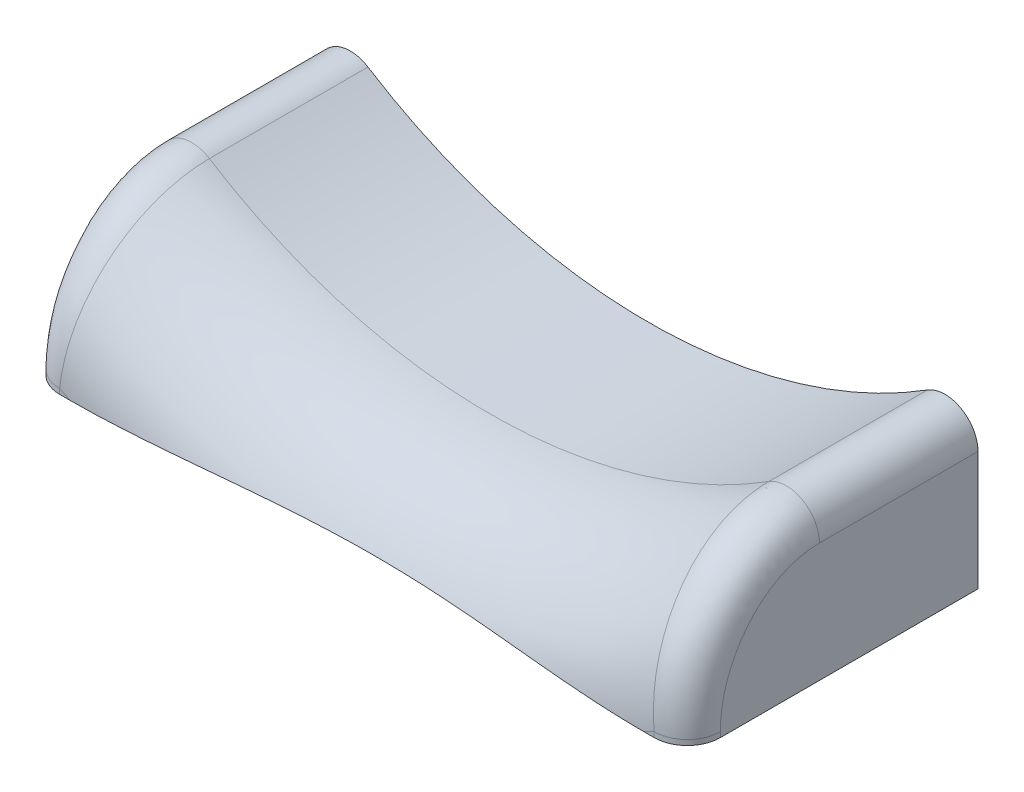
SolidWorks part; units mm, degrees
ref_plane "Front Plane" through (0, 0, 0) normal (0, 0, 1) x (1, 0, 0)
ref_plane "Top Plane" through (0, 0, 0) normal (0, 1, 0) x (1, 0, 0)
ref_plane "Right Plane" through (0, 0, 0) normal (1, 0, 0) x (0, 0, -1)
sketch "Sketch1" plane through (0, 0, 0) normal (0, 1, 0) x (1, 0, 0)
  circle A0 centre (0, 0) radius 35
  dimension "D1" = 70
extrude "Boss-Extrude1" add sketch "Sketch1" along normal blind 2
sketch "Sketch2" plane through (0, 2, 0) normal (0, 1, 0) x (1, 0, 0)
  circle A0 centre (-17.75, 17.75) radius 3.25
  circle A1 centre (17.75, 17.75) radius 3.25
  circle A2 centre (17.75, -17.75) radius 3.25
  circle A3 centre (-17.75, -17.75) radius 3.25
  dimension "D1" = 6.5
  dimension "D2" = 35.5
  dimension "D3" = 17.75
  dimension "D4" = 35.5
  dimension "D5" = 17.75
  dimension "D6" = 35.5
  dimension "D7" = 17.75
  dimension "D8" = 35.5
  dimension "D9" = 17.75
sketch "Sketch4" plane through (0, 2, 0) normal (0, 1, 0) x (1, 0, 0)
  line L0 (-25.4755, -24) -> (25.4755, -24)
  arc A0 (-25.4755, -24) -> (25.4755, -24) centre (0, 0) ccw
  dimension "D1" = 24
extrude "Cut-Extrude3" cut sketch "Sketch4" against normal blind 10
extrude "Cut-Extrude4" cut sketch "Sketch2" against normal through all
sketch "Sketch5" plane through (0, 0, 24) normal (0, 0, 1) x (1, 0, 0)
  line L0 (-50, 0) -> (50, 0)
  line L1 (50, 0) -> (50, 24)
  line L2 (50, 24) -> (-50, 24)
  line L3 (-50, 24) -> (-50, 0)
  dimension "D1" = 24
  dimension "D2" = 100
  dimension "D3" = 50
extrude "Boss-Extrude2" add sketch "Sketch5" along normal blind 120
sketch "Sketch7" plane through (0, 0, 144) normal (0, 0, 1) x (1, 0, 0)
  line L0 (50, 24) -> (-50, 24) construction
  line L1 (-50, 0) -> (50, 0) construction
  arc A0 (-45, 24) -> (45, 24) centre (0, 89.3214) ccw
  point P3 (0, 10)
  dimension "D3" = 10
  dimension "D1" = 90
  dimension "D2" = 45
extrude "Cut-Extrude6" cut sketch "Sketch7" against normal through all and the other way through all
sketch "Sketch9" plane through (0, 24, 0) normal (0, 1, 0) x (1, 0, 0)
  line L0 (-25.4755, -24) -> (25.4755, -24)
  arc A0 (-25.4755, -24) -> (25.4755, -24) centre (0, 0) ccw
extrude "Cut-Extrude7" cut sketch "Sketch9" against normal blind 22
sketch "Sketch11" plane through (0, 24, 0) normal (0, 1, 0) x (1, 0, 0)
  line L0 (0, -35) -> (-25.4755, -35)
  line L2 (-25.4755, -24) -> (-25.4755, -35)
  line L3 (-25.4755, -24) -> (25.4755, -24)
  line L4 (25.4755, -24) -> (25.4755, -35)
  line L6 (25.4755, -35) -> (0, -35)
  arc A0 (-25.4755, -24) -> (25.4755, -24) centre (0, 0) ccw construction
extrude "Cut-Extrude9" cut sketch "Sketch11" against normal blind 14
fillet "Fillet4" radius 20 4 edges at (25.4755, 14.2023, 29.5) (12.9099, 11.0576, 35) (-25.4755, 14.2023, 29.5) (-12.9099, 11.0576, 35)
fillet "Fillet6" radius 20 1 edges at (0, 10, 144)
fillet "Fillet7" radius 5 4 edges at (50, 1.7517, 144) (-50, 1.7517, 144) (50, 18.095, 139.7727) (-50, 13.5033, 142.1035)
ref_plane "Plane1" through (0, 0, 100) normal (0, 0, 1) x (1, 0, 0)
ref_plane "Plane2" through (0, 0, 70) normal (0, 0, 1) x (1, 0, 0)
ref_plane "Plane3" through (0, 0, 24) normal (0, 0, -1) x (-1, 0, 0)
sketch "Sketch12" plane through (0, 0, 100) normal (0, 0, 1) x (1, 0, 0)
  line L1 (55.7357, -6.8329) -> (-58.5698, -6.8329)
  line L2 (55.7357, -6.8329) -> (55.7357, 29.8519)
  line L3 (55.7357, 29.8519) -> (-58.5698, 29.8519)
  line L4 (-58.5698, -6.8329) -> (-58.5698, 29.8519)
extrude "Cut-Extrude10" cut sketch "Sketch12" against normal through all
sketch "Sketch13" plane through (0, 0, 100) normal (0, 0, -1) x (-1, 0, 0)
  line L0 (50, 0) -> (-50, 0) construction
  circle A0 centre (-38, 9) radius 4
  circle A1 centre (38, 9) radius 4
  dimension "D3" = 8
  dimension "D4" = 8
  dimension "D1" = 38
  dimension "D2" = 38
  dimension "D5" = 9
  dimension "D6" = 9
extrude "Cut-Extrude11" cut sketch "Sketch13" against normal blind 6
